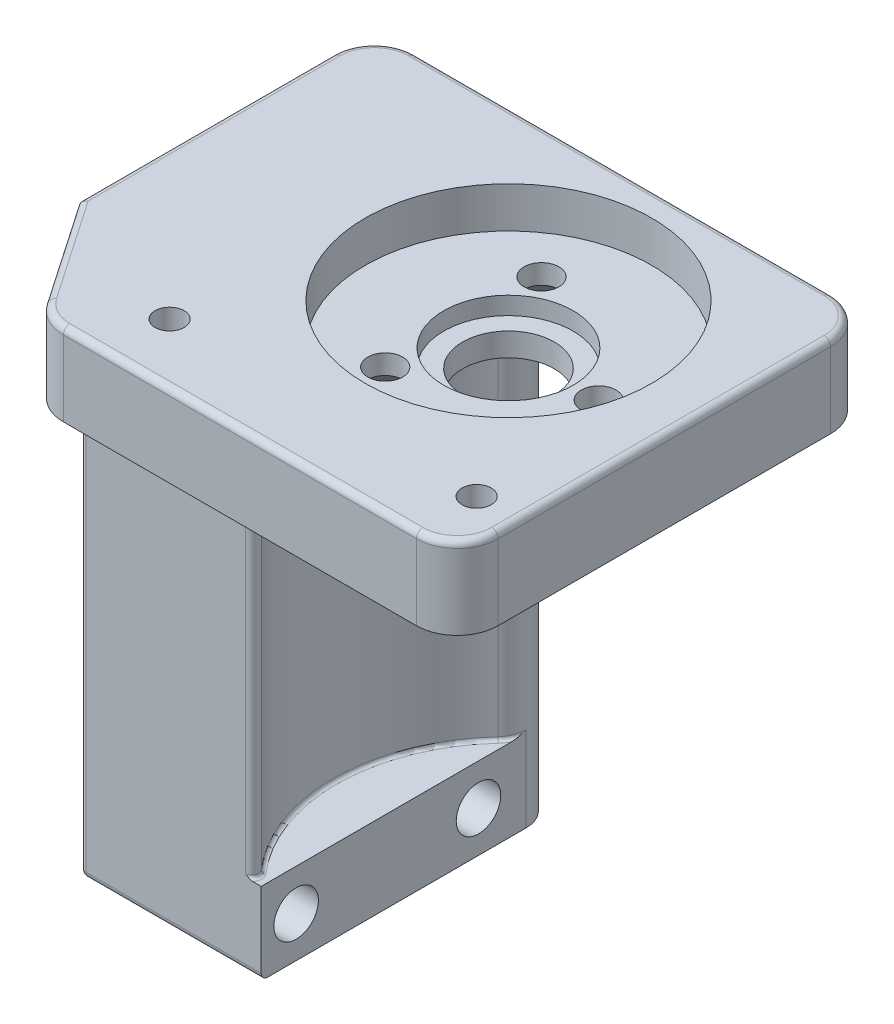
SolidWorks part; units mm, degrees
ref_plane "Front Plane" through (0, 0, 0) normal (0, 0, 1) x (1, 0, 0)
ref_plane "Top Plane" through (0, 0, 0) normal (0, 1, 0) x (1, 0, 0)
ref_plane "Right Plane" through (0, 0, 0) normal (1, 0, 0) x (0, 0, -1)
sketch "Sketch1" plane through (0, 0, 0) normal (1, 0, 0) x (0, 0, -1)
  line L0 (-19.05, 0) -> (0, 0) construction
  line L1 (-19.05, 3.175) -> (19.05, 3.175)
  line L2 (-19.05, 3.175) -> (-19.05, -3.175)
  line L3 (-19.05, -3.175) -> (19.05, -3.175)
  line L4 (19.05, 3.175) -> (19.05, -3.175)
  dimension "D1" = 6.35
  dimension "D2" = 38.1
  dimension "D3" = 19.05
extrude "Extrude1" add sketch "Sketch1" along normal mid plane 30.1625
sketch "Sketch2" plane through (0, 3.175, 0) normal (0, 1, 0) x (1, 0, 0)
  circle A0 centre (0, 0) radius 11.1125
  dimension "D2" = 22.225
extrude "Cut-Extrude1" cut sketch "Sketch2" against normal blind 3.175
sketch "Sketch3" plane through (0, 0, 0) normal (0, 1, 0) x (1, 0, 0)
  circle A0 centre (0, 0) radius 5.0165
  dimension "D1" = 10.033
extrude "Cut-Extrude2" cut sketch "Sketch3" against normal blind 1.3716
sketch "Sketch4" plane through (0, -1.3716, 0) normal (0, 1, 0) x (1, 0, 0)
  circle A0 centre (0, 0) radius 3.556
  dimension "D1" = 7.112
extrude "Cut-Extrude3" cut sketch "Sketch4" against normal up to next
sketch "Sketch5" plane through (0, -3.175, 0) normal (0, -1, 0) x (1, 0, 0)
  line L0 (-3.4988, 6.0602) -> (-3.4989, -6.0602) construction
  circle A0 centre (-3.4988, 6.0602) radius 1.016
  circle A2 centre (6.9977, 0) radius 1.016
  circle A3 centre (-3.4989, -6.0602) radius 1.016
  circle A4 centre (0, 0) radius 6.9977 construction
  dimension "D1" = 2.032
  dimension "D3" = 13.9954
  dimension "D4" = 3
extrude "Cut-Extrude4" cut sketch "Sketch5" against normal up to next
hole_wizard "CSK for M2.5 Flat Head Machine Screw1" positions "3DSketch1" profile "Sketch6" countersink size "M2.5" standard "ANSI Metric"
sketch3d "3DSketch1"
  line L0 (6.9977, 0, 0) -> (6.9977, -3.175, 0) construction
  line L1 (-3.4989, 0, -6.0602) -> (-3.4989, -3.175, -6.0602) construction
  line L2 (-3.4988, 0, 6.0602) -> (-3.4988, -3.175, 6.0602) construction
  point P0 (6.9977, -3.175, 0)
  point P2 (-3.4989, -3.175, -6.0602)
  point P4 (-3.4988, -3.175, 6.0602)
sketch "Sketch6" plane through (6.9977, -3.175, 0) normal (1, 0, 0) x (0, 0, -1)
  line L0 (0, 0) -> (0, 6.35)
  line L1 (0, 6.35) -> (1.35, 6.35)
  line L2 (1.35, 6.35) -> (1.35, 1.654)
  line L3 (1.35, 1.654) -> (3.004, 0)
  line L5 (3.004, 0) -> (0, 0)
  line L6 (-1.35, 1.654) -> (-3.004, 0) construction
  line L11 (0, -6.35) -> (0, 107.95) construction
  dimension "Thru Hole Dia." = 2.7
  dimension "Thru Hole Depth" = 6.35
  dimension "Near C'Sink Dia." = 6.008
  dimension "Near C'Sink Angle" = 90
sketch "Sketch12" plane through (0, 3.175, 0) normal (0, 1, 0) x (1, 0, 0)
  circle A0 centre (0, 0) radius 4.7625
  dimension "D1" = 9.525
extrude "Cut-Extrude6" [suppressed] cut sketch "Sketch12" against normal up to next
hole_wizard "#4-40 Tapped Hole1" positions "Sketch21" profile "Sketch20" tap size "#4-40" standard "ANSI Inch"
sketch "Sketch21" plane through (0, 3.175, 0) normal (0, 1, 0) x (1, 0, 0)
  line L0 (15.0812, -19.05) -> (-15.0812, -19.05) construction
  point P0 (11.9063, -14.3764)
  point P4 (-11.9062, -14.3764)
  dimension "D1" = 4.6736
  dimension "D2" = 11.9062
  dimension "D3" = 11.9062
sketch "Sketch20" plane through (11.9063, 3.175, 14.3764) normal (1, 0, 0) x (0, 0, 1)
  line L0 (0, 0) -> (0, 6.35)
  line L1 (0, 6.35) -> (1.1303, 6.35)
  line L2 (1.1303, 6.35) -> (1.1303, 0)
  line L5 (1.1303, 0) -> (0, 0)
  line L11 (0, -6.35) -> (0, 107.95) construction
  dimension "Thread Major Dia." = 2.2606
  dimension "Thru Tap Drill Depth" = 6.35
ref_plane "Plane1" through (0, 0, 9.779) normal (0, 0, 1) x (1, 0, 0)
sketch "Sketch22" plane through (0, 0, 9.779) normal (0, 0, 1) x (1, 0, 0)
  line L0 (-15.0812, 3.175) -> (-23.495, 3.175)
  line L1 (-23.495, 3.175) -> (-23.495, -42.3227)
  line L2 (-23.495, -42.3227) -> (-9.398, -42.3227)
  line L3 (-9.398, -57.0547) -> (-9.398, -35.9727) construction
  line L4 (-9.398, -42.3227) -> (-9.398, -35.9727)
  line L5 (-9.398, -35.9727) -> (-17.145, -35.9727)
  line L6 (-17.145, -35.9727) -> (-17.145, -3.175)
  line L7 (-17.145, -3.175) -> (-15.0812, -3.175)
  line L8 (-15.0812, -3.175) -> (-15.0812, 3.175)
  line L9 (-15.875, -7.9375) -> (-15.875, -6.35) construction
  dimension "D1" = 6.35
  dimension "D2" = 1.27
  dimension "D3" = 6.35
extrude "Boss-Extrude1" add sketch "Sketch22" against normal blind 22.86
sketch "Sketch23" plane through (0, 3.175, 0) normal (0, 1, 0) x (1, 0, 0)
  line L0 (-15.0812, -9.779) -> (-23.495, -9.779) construction
  line L5 (-23.495, 13.081) -> (-23.495, -9.779) construction
  line L6 (-15.0812, -9.779) -> (-15.0812, -19.05)
  line L7 (-23.495, -9.779) -> (-15.0812, -9.779)
  line L8 (-17.145, -19.05) -> (-23.495, -9.779)
  line L9 (-15.0812, -19.05) -> (-17.145, -19.05)
extrude "Boss-Extrude2" add sketch "Sketch23" against normal up to surface (6.35 mm away)
sketch "Sketch27" plane through (0, -35.9727, 0) normal (0, -1, 0) x (1, 0, 0)
  line L2 (-10.6195, 9.779) -> (-17.145, 9.779)
  line L3 (-9.398, -13.081) -> (-9.398, 9.779) construction
  line L4 (-23.495, 9.779) -> (-9.398, 9.779) construction
  line L5 (-17.145, 9.779) -> (-17.145, -13.081)
  line L6 (-17.145, -13.081) -> (-11.7185, -13.081)
  line L7 (-9.398, -13.081) -> (-23.495, -13.081) construction
  line L8 (-23.495, -13.081) -> (-9.398, -13.081) construction
  arc A0 (-10.6195, 9.779) -> (-10.2368, 8.9369) centre (-10.6195, 9.271) cw
  arc A1 (-10.2368, 8.9369) -> (-10.0093, -9.191) centre (0, 0) ccw
  arc A2 (-11.7185, -13.081) -> (-10.0093, -9.191) centre (-11.7185, -10.7605) ccw
  dimension "D1" = 13.589
  dimension "D2" = 0.508
extrude "Boss-Extrude4" add sketch "Sketch27" against normal up to surface (32.7977 mm away)
sketch "Sketch28" plane through (0, -3.175, 0) normal (0, -1, 0) x (1, 0, 0)
  line L1 (-15.0812, -13.081) -> (15.0812, -13.081)
  line L2 (-15.0812, -13.081) -> (-15.0812, -19.05)
  line L3 (-15.0812, -19.05) -> (15.0812, -19.05)
  line L4 (15.0812, -13.081) -> (15.0812, -19.05)
extrude "Cut-Extrude7" cut sketch "Sketch28" against normal through all
sketch "Sketch30" plane through (0, -42.3227, 0) normal (0, -1, 0) x (1, 0, 0)
  line L4 (-11.7185, -13.081) -> (-9.398, -13.081)
  line L5 (-9.398, -13.081) -> (-9.398, -10.7605)
  arc A1 (-11.7185, -13.081) -> (-9.398, -10.7605) centre (-11.7185, -10.7605) ccw
  arc A2 (-11.7185, -13.081) -> (-9.398, -10.7605) centre (-11.7185, -10.7605) ccw construction
extrude "Cut-Extrude8" cut sketch "Sketch30" against normal up to surface (6.35 mm away)
fillet "Fillet1" radius 3.175 4 edges at (15.0812, 0, 19.05) (-17.145, 0, 19.05) (15.0812, 0, -13.081) (-23.495, -19.5739, -13.081)
fillet "Fillet2" radius 0.508 14 edges at (-16.4465, -42.3227, 9.779) (-16.0192, -42.3227, -13.081) (-23.495, -42.3227, -0.0635) (-23.495, -22.7489, 9.779) (-22.5651, -42.3227, -12.1511) (14.1513, 3.175, 18.1201) (15.0812, 3.175, 2.9845) (14.1513, 3.175, -12.1511) (-4.2069, 3.175, -13.081) (-22.5651, 3.175, -12.1511) (-23.495, 3.175, -0.0635) (-20.7929, 3.175, 13.7241) (-16.9519, 3.175, 18.6837) (-1.7825, 3.175, 19.05)
fillet "Fillet4" radius 1.27 5 edges at (-9.594, -3.175, -11.694) (-23.3462, -3.175, 9.6302) (-16.8033, -3.175, 9.779) (-10.157, -3.175, 9.4812) (-13.5879, -3.175, -0.1706)
fillet "Fillet5" radius 0.254 3 edges at (-9.5562, -35.9727, -9.9184) (-10.157, -35.9727, 9.4812) (-13.5879, -35.9727, -0.1706)
hole_wizard "#29 (0.136) Diameter Hole1" positions "Sketch31" profile "Sketch32" hole size "#29" standard "ANSI Inch"
sketch "Sketch31" plane through (-23.495, 0, 0) normal (-1, 0, 0) x (0, 0, 1)
  line L0 (-7.0739, -39.1477) -> (7.0739, -39.1477) construction
  line L2 (0, 0) -> (0, -39.1477) construction
  line L4 (0, -35.9727) -> (0, -42.3227) construction
  line L6 (8.7699, -35.9727) -> (-9.0192, -35.9727) construction
  line L7 (9.271, -42.3227) -> (-9.906, -42.3227) construction
  point P0 (-7.0739, -39.1477)
  point P2 (7.0739, -39.1477)
  dimension "D1" = 14.1478
sketch "Sketch32" plane through (-23.495, -39.1477, -7.0739) normal (0, 1, 0) x (0, 0, 1)
  line L0 (0, 0) -> (0, 38.5763)
  line L1 (0, 38.5763) -> (1.7272, 38.5763)
  line L2 (1.7272, 38.5763) -> (1.7272, 0)
  line L5 (1.7272, 0) -> (0, 0)
  line L11 (0, -6.35) -> (0, 107.95) construction
  dimension "Thru Hole Dia." = 3.4544
  dimension "Thru Hole Depth" = 38.5763
